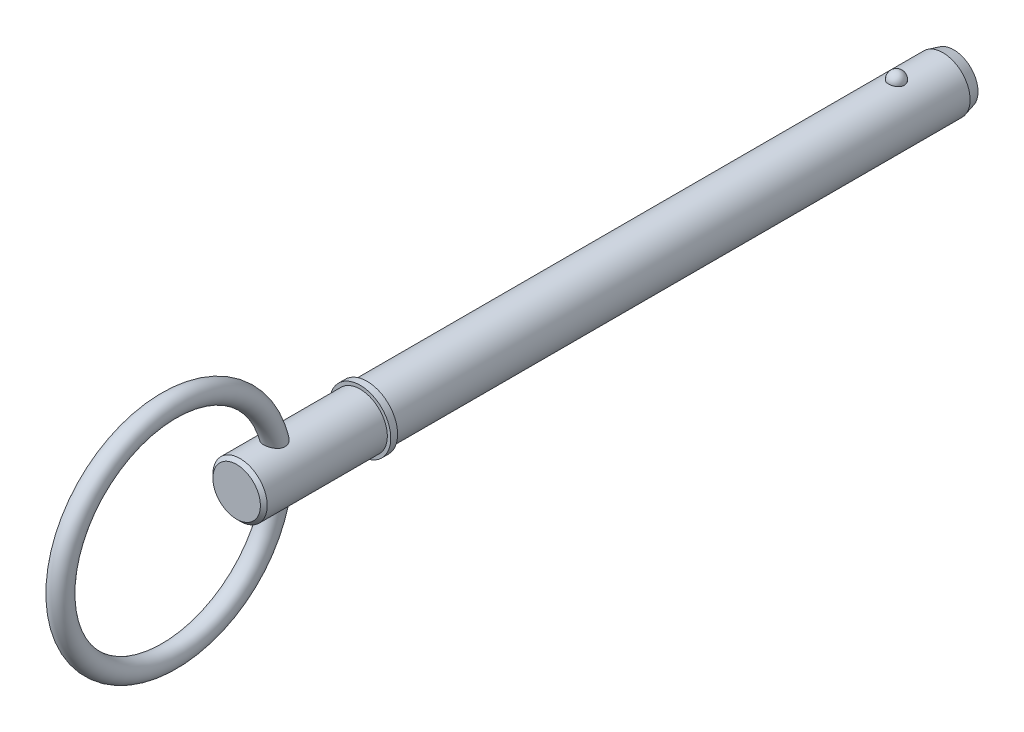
SolidWorks part; units mm, degrees
ref_plane "Front Plane" through (0, 0, 0) normal (0, 0, 1) x (1, 0, 0)
ref_plane "Top Plane" through (0, 0, 0) normal (0, 1, 0) x (1, 0, 0)
ref_plane "Right Plane" through (0, 0, 0) normal (1, 0, 0) x (0, 0, -1)
sketch "Sketch2" plane through (0, 0, 0) normal (0, 0, 1) x (1, 0, 0)
  circle A0 centre (0, 0) radius 3.97
  point P3 (0, 3.97)
  dimension "D1" = 7.94
extrude "Boss-Extrude1" add sketch "Sketch2" along normal blind 76.2
sketch "Sketch3" plane through (0, 0, 0) normal (0, 0, -1) x (-1, 0, 0)
  circle A0 centre (0, 0) radius 3.97
  dimension "D1" = 7.94
extrude "Boss-Extrude2" add sketch "Sketch3" along normal blind 9.53
chamfer "Chamfer1" distance 1.586 angle 15 1 edges at (-3.97, 0, -9.53)
sketch "Sketch18" plane through (0, 0, 0) normal (1, 0, 0) x (0, 0, -1)
  line L0 (7.944, 3.97) -> (-76.2, 3.97) construction
  line L1 (1.15, 5.12) -> (1.15, 2.82)
  line L2 (-76.2, -3.97) -> (7.944, -3.97) construction
  arc A0 (1.15, 5.12) -> (1.15, 2.82) centre (1.15, 3.97) ccw
  point P4 (0, 3.97)
  dimension "D1" = 9.09
revolve "Revolve1" add sketch "Sketch18" angle 360 about L1
sketch "Sketch19" plane through (0, 0, 0) normal (1, 0, 0) x (0, 0, -1)
  line L0 (-33.7288, 0) -> (-46.4542, 0) construction
sketch "Sketch20" plane through (0, 0, 0) normal (1, 0, 0) x (0, 0, -1)
  line L0 (-76.2, 0) -> (-76.2, 4.47)
  line L1 (-76.2, 3.97) -> (-76.2, -3.97) construction
  line L2 (-76.2, 4.47) -> (-77.2, 4.47)
  line L3 (-77.2, 4.47) -> (-77.2, 0)
  line L4 (-33.7288, 0) -> (-46.4542, 0) construction
  line L5 (-77.2, 0) -> (-76.2, 0)
  dimension "D1" = 4.47
  dimension "D2" = 1
revolve "Revolve2" add sketch "Sketch20" angle 360 about L0
sketch "Sketch21" plane through (0, 0, 76.2) normal (0, 0, -1) x (-1, 0, 0)
  circle A0 centre (0, 0) radius 3.97
  dimension "D1" = 7.94
extrude "Boss-Extrude3" add sketch "Sketch21" against normal blind 19.05
chamfer "Chamfer2" distance 0.5 angle 45 1 edges at (-3.97, 0, 95.25)
sketch "Sketch23" plane through (0, 0, 0) normal (1, 0, 0) x (0, 0, -1)
  line L0 (-95.25, 3.47) -> (-95.25, -3.47) construction
  circle A0 centre (-105.125, 0) radius 15.875
  point P2 (-89.25, 0)
  dimension "D1" = 31.75
  dimension "D2" = 6
sketch "Sketch24" plane through (0, 0, 0) normal (0, 1, 0) x (1, 0, 0)
  circle A0 centre (0, -89.25) radius 1.5
  dimension "D1" = 3
sweep "Sweep1" add profiles "Sketch24" path "Sketch23"
